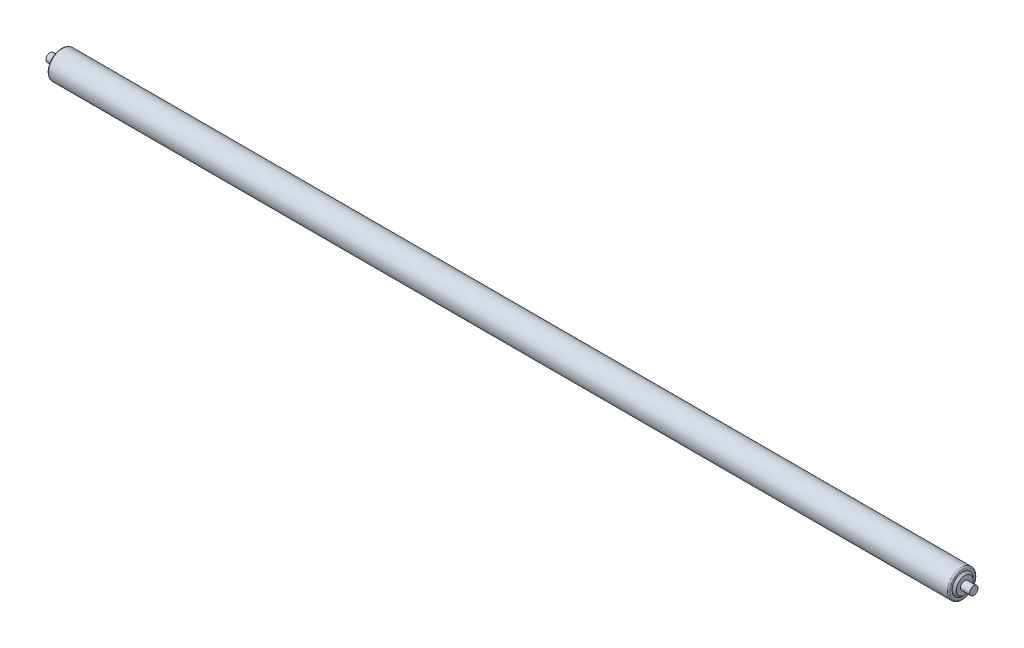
SolidWorks part; units mm, degrees
ref_plane "Plan de face" through (0, 0, 0) normal (0, 0, 1) x (1, 0, 0)
ref_plane "Plan de dessus" through (0, 0, 0) normal (0, 1, 0) x (1, 0, 0)
ref_plane "Plan de droite" through (0, 0, 0) normal (1, 0, 0) x (0, 0, -1)
sketch "Esquisse1" plane through (0, 0, 0) normal (0, 0, 1) x (1, 0, 0)
  line L0 (-321.5, 10) -> (321.5, 10)
  line L1 (-330.5, 0) -> (-330.5, 3)
  line L2 (-330.5, 3) -> (-325, 3)
  line L3 (-322.5, 7.5) -> (-322.5, 9)
  line L4 (330.5, 0) -> (330.5, 3)
  line L5 (330.5, 3) -> (324, 3)
  line L6 (330.5, 0) -> (-330.5, 0)
  line L7 (322.5, 7.5) -> (322.5, 9)
  line L8 (-322.5, 7.5) -> (-325, 6)
  line L9 (-325, 6) -> (-325, 3)
  line L10 (0, 0) -> (0, 55.5715) construction
  line L11 (322.5, 7.5) -> (324, 6)
  line L12 (324, 6) -> (324, 3)
  arc A0 (322.5, 9) -> (321.5, 10) centre (321.5, 9) ccw
  arc A1 (-322.5, 9) -> (-321.5, 10) centre (-321.5, 9) cw
  point P18 (0, 10)
  dimension "D3" = 1
  dimension "D1" = 3
  dimension "D2" = 10
  dimension "D4" = 3
  dimension "D5" = 645
  dimension "D6" = 649
  dimension "D7" = 6.5
  dimension "D8" = 661
  dimension "D9" = 6
  dimension "D10" = 45
revolve "Révolution1" add sketch "Esquisse1" angle 360 about L6
